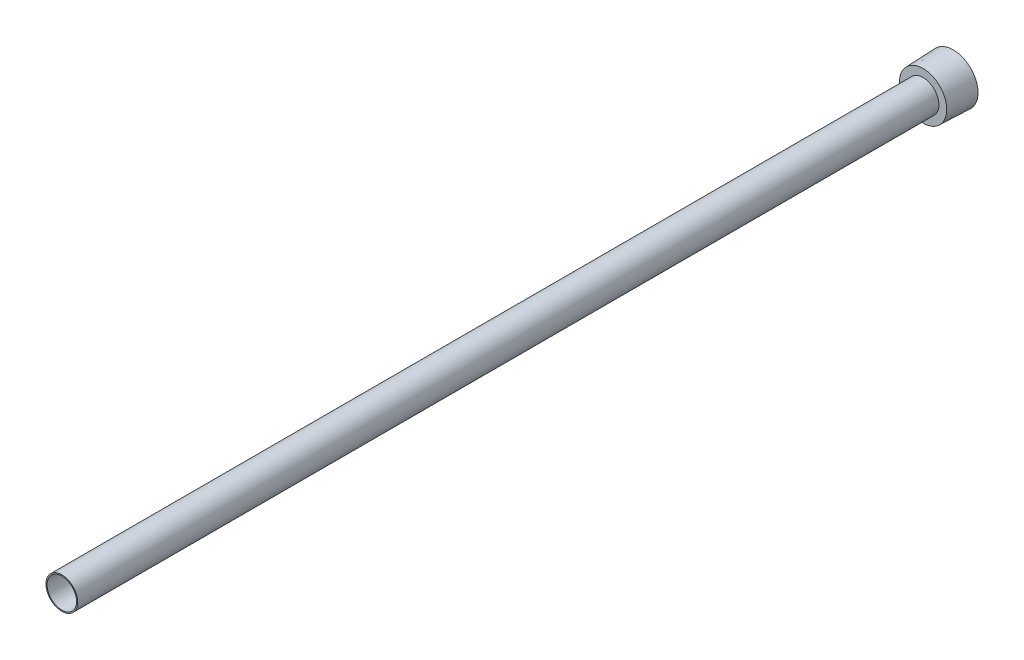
SolidWorks part; units mm, degrees
ref_plane "Front Plane" through (0, 0, 0) normal (0, 0, 1) x (1, 0, 0)
ref_plane "Top Plane" through (0, 0, 0) normal (0, 1, 0) x (1, 0, 0)
ref_plane "Right Plane" through (0, 0, 0) normal (1, 0, 0) x (0, 0, -1)
sketch "Sketch1" plane through (0, 0, 0) normal (1, 0, 0) x (0, 0, -1)
  line L0 (-168.7934, 0) -> (49831.2066, 0) construction
  line L6 (0, 0) -> (0, 8.4709)
  line L7 (0, 8.4709) -> (-10.3124, 8.0947)
  line L8 (-10.3124, 8.0947) -> (-10.3124, 5.4229)
  line L9 (-10.3124, 5.4229) -> (-304.8, 5.4229)
  line L10 (-304.8, 5.4229) -> (-304.8, 0)
  line L11 (0, 0) -> (-304.8, 0)
  dimension "D1" = 10.3124
  dimension "D2" = 16.9418
  dimension "D3" = 2.089
  dimension "D4" = 10.8458
  dimension "D5" = 304.8
revolve "Revolve1" add sketch "Sketch1" angle 360 about L0
sketch "Sketch2" plane through (0, 0, 304.8) normal (0, 0, 1) x (1, 0, 0)
  circle A0 centre (0, 0) radius 5.0419
  dimension "D1" = 10.0838
extrude "Cut-Extrude1" cut sketch "Sketch2" against normal through all
sketch "Sketch3" plane through (0, 0, 0) normal (0, 0, -1) x (-1, 0, 0)
  line L0 (0, 9.318) -> (0, -9.318) construction
  line L1 (0, -6.4158) -> (5.5562, -3.2079)
  line L2 (5.5562, -3.2079) -> (5.5562, 3.2079)
  line L3 (5.5562, 3.2079) -> (0, 6.4158)
  line L4 (0, 6.4158) -> (-5.5563, 3.2079)
  line L5 (-5.5563, 3.2079) -> (-5.5563, -3.2079)
  line L6 (-5.5563, -3.2079) -> (0, -6.4158)
  circle A0 centre (0, 0) radius 5.5563 construction
  dimension "D1" = 11.1125
extrude "Cut-Extrude2" cut sketch "Sketch3" against normal blind 6.35
